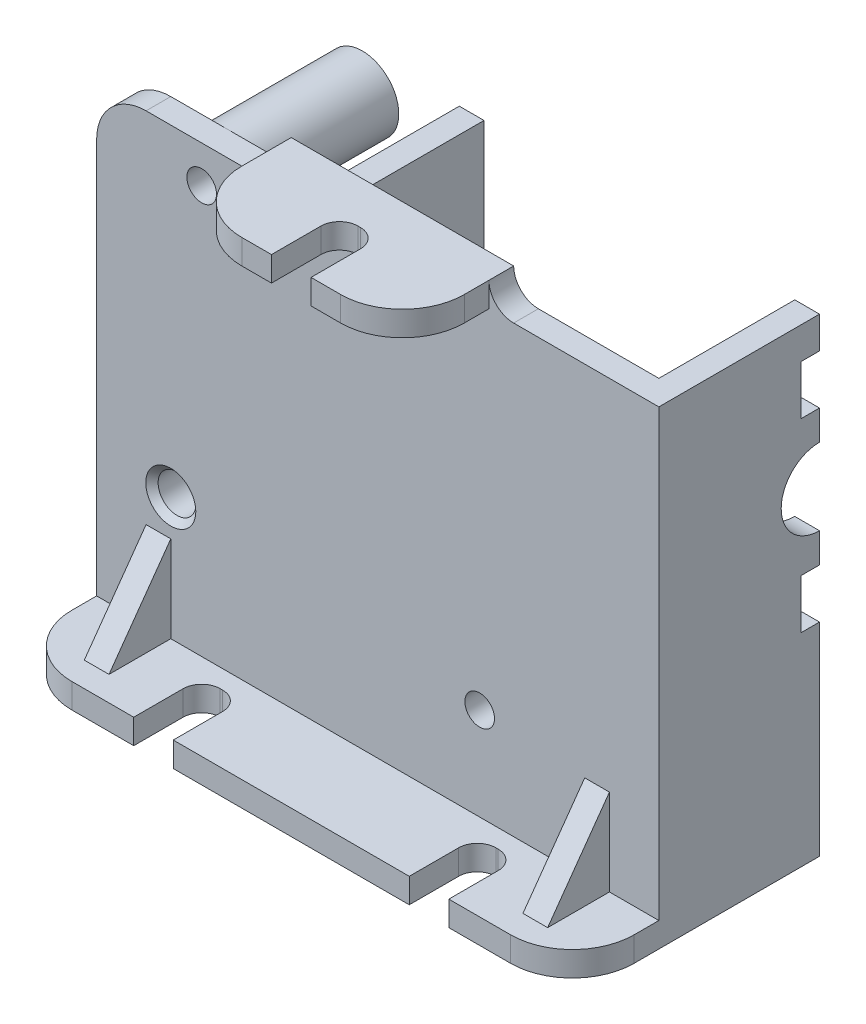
SolidWorks part; units mm, degrees
ref_plane "Face" through (0, 0, 0) normal (0, 0, 1) x (1, 0, 0)
ref_plane "Dessus" through (0, 0, 0) normal (0, 1, 0) x (1, 0, 0)
ref_plane "Droite" through (0, 0, 0) normal (1, 0, 0) x (0, 0, -1)
sketch "Esquisse1" plane through (0, 0, 0) normal (0, 0, 1) x (1, 0, 0)
  line L0 (-18.636, 0) -> (40.6725, 0) construction
  line L1 (0, 13.4516) -> (0, -31.9474) construction
  line L2 (-13.58, -13.58) -> (12.9107, -13.58) construction
  line L3 (11, 10.3689) -> (11, -7.2863) construction
  line L4 (12.35, 12.5556) -> (12.35, -11.4741) construction
  line L5 (37.5, 12.5556) -> (37.5, -10.7539) construction
  line L6 (-16.5535, -25.5) -> (42.4584, -25.5) construction
  line L7 (-16.0297, -27.5) -> (41.191, -27.5) construction
  line L8 (-6, 14.3889) -> (-6, -30.5277) construction
  line L9 (12.35, 10.45) -> (38.7737, 10.45) construction
  line L10 (11.7976, -10.45) -> (39.5594, -10.45) construction
  line L11 (39.5, 11.377) -> (39.5, -30.9205) construction
  line L12 (-10.1369, 12.5) -> (39.5, 12.5) construction
  line L14 (-6, 12.5) -> (39.5, 12.5)
  line L15 (-6, 12.5) -> (-6, -25.5)
  line L16 (-6, -25.5) -> (39.5, -25.5)
  line L17 (39.5, 12.5) -> (39.5, -25.5)
  circle A0 centre (0, -13.58) radius 11.5 construction
  circle A1 centre (0, -13.58) radius 1.5
extrude "Base-Extrusion" add sketch "Esquisse1" along normal mid plane 26
sketch "Esquisse5" plane through (0, 12.5, 0) normal (0, 1, 0) x (-1, 0, 0)
  line L0 (-12.35, -16.3279) -> (-12.35, 15.7701) construction
  line L1 (-10.35, -15.9222) -> (-10.35, 14.6545) construction
  line L2 (-37.5, -14.3503) -> (-37.5, 16.7842) construction
  line L3 (-39.5, -13.7925) -> (-39.5, 16.3786) construction
  line L4 (-40.8108, 11) -> (9.1448, 11) construction
  line L5 (-41.2165, -11) -> (8.3249, -11) construction
  line L7 (-37.5, 11) -> (-12.35, 11)
  line L8 (-37.5, 11) -> (-37.5, -11)
  line L9 (-37.5, -11) -> (-12.35, -11)
  line L10 (-12.35, 11) -> (-12.35, -11)
  line L11 (-10.35, 11) -> (8.7031, 11)
  line L12 (-10.35, 11) -> (-10.35, -11)
  line L13 (-10.35, -11) -> (8.7031, -11)
  line L14 (8.7031, 11) -> (8.7031, -11)
extrude "Enlèv. mat.-Extru.6" cut sketch "Esquisse5" against normal blind 40
sketch "Esquisse3" plane through (0, 0, 13) normal (0, 0, 1) x (1, 0, 0)
  circle A0 centre (0, -13.58) radius 3.5
extrude "Boss.-Extru.1" add sketch "Esquisse3" against normal blind 25
sketch "Esquisse4" plane through (0, 0, 13) normal (0, 0, 1) x (1, 0, 0)
  circle A0 centre (0, -13.58) radius 1.525
extrude "Enlèv. mat.-Extru.2" cut sketch "Esquisse4" against normal through all
sketch "Esquisse6" plane through (39.5, 0, 0) normal (1, 0, 0) x (0, 0, -1)
  line L0 (-13.8762, 0) -> (18.6073, 0) construction
  line L1 (0, 14.021) -> (0, -22.5589) construction
  circle A0 centre (0, 0.42) radius 3.025
extrude "Enlèv. mat.-Extru.3" cut sketch "Esquisse6" against normal through all
sketch "Esquisse7" plane through (39.5, 0, 0) normal (1, 0, 0) x (0, 0, -1)
  circle A0 centre (0, 0.42) radius 3.1
extrude "Enlèv. mat.-Extru.4" cut sketch "Esquisse7" against normal blind 3
sketch "Esquisse8" plane through (0, -25.5, 0) normal (0, -1, 0) x (1, 0, 0)
  line L0 (-6, 21.1962) -> (-6, -20.9902) construction
  line L1 (39.5, 20.4108) -> (39.5, -20.9902) construction
  line L2 (41.0671, -20) -> (-8.3785, -20) construction
  line L3 (-7.8207, 20) -> (40.3571, 20) construction
  line L5 (-6, 20) -> (39.5, 20)
  line L6 (-6, 20) -> (-6, 11.9399)
  line L7 (-6, 11.9399) -> (39.5, 11.9399)
  line L8 (39.5, 20) -> (39.5, 11.9399)
  line L9 (-6, -20) -> (39.5, -20)
  line L10 (-6, -20) -> (-6, -11.5095)
  line L11 (-6, -11.5095) -> (39.5, -11.5095)
  line L12 (39.5, -20) -> (39.5, -11.5095)
extrude "Boss.-Extru.2" add sketch "Esquisse8" against normal blind 2
sketch "Esquisse9" plane through (0, 12.5, 0) normal (0, 1, 0) x (-1, 0, 0)
  line L0 (6.6791, -3.1) -> (-6.4741, -3.1) construction
  line L1 (7.282, 3.1) -> (-7.5154, 3.1) construction
  line L3 (6.6791, -3.1) -> (-4.7203, -3.1)
  line L4 (6.6791, -3.1) -> (6.6791, 3.1)
  line L5 (6.6791, 3.1) -> (-4.7203, 3.1)
  line L6 (-4.7203, -3.1) -> (-4.7203, 3.1)
extrude "Enlèv. mat.-Extru.5" cut sketch "Esquisse9" against normal blind 32
sketch "Esquisse12" plane through (0, 0, 0) normal (0, 0, 1) x (1, 0, 0)
  line L0 (-4.6513, 9.5) -> (15.1881, 9.5) construction
  line L1 (18.2023, -16) -> (33.4929, -16) construction
  line L2 (25, -8.6922) -> (25, -25.0789) construction
  line L3 (2.5, 14.9287) -> (2.5, -0.5811) construction
  circle A0 centre (2.5, 9.5) radius 2.95
  circle A1 centre (25, -16) radius 2.95
extrude "Boss.-Extru.3" add sketch "Esquisse12" along normal mid plane 26
sketch "Esquisse13" plane through (0, 0, 0) normal (0, 0, 1) x (1, 0, 0)
  circle A0 centre (2.5, 9.5) radius 1.2
  circle A1 centre (25, -16) radius 1.2
extrude "Enlèv. mat.-Extru.8" cut sketch "Esquisse13" against normal mid plane 32
sketch "Esquisse14" plane through (0, -23.5, 0) normal (0, 1, 0) x (-1, 0, 0)
  line L0 (8.0853, 0) -> (-43.1429, 0) construction
  line L1 (-4, -22.6142) -> (-4, -6.692) construction
  line L2 (-39.5, -22.6142) -> (-39.5, -10.961) construction
  line L3 (-16.75, -22.0374) -> (-16.75, -8.8265) construction
  line L4 (-7.2, -22.0374) -> (-7.2, -8.8265) construction
  line L5 (2.9509, -14.5) -> (-11.9906, -14.5) construction
  line L6 (-26.3, -21.5758) -> (-26.3, -16)
  line L7 (-4, -21.5758) -> (-7.2, -21.5758)
  line L8 (-4, -21.5758) -> (-4, -16)
  line L9 (-5.5, -14.5) -> (-5.7, -14.5)
  line L10 (-7.2, -21.5758) -> (-7.2, -16)
  line L11 (-28, -14.5) -> (-27.8, -14.5)
  line L12 (-29.5, -21.5758) -> (-29.5, -16)
  line L13 (-29.5, -21.5758) -> (-26.3, -21.5758)
  line L14 (-29.5, 21.5758) -> (-26.3, 21.5758)
  line L15 (-29.5, 21.5758) -> (-29.5, 16)
  line L16 (-28, 14.5) -> (-27.8, 14.5)
  line L17 (-7.2, 21.5758) -> (-7.2, 16)
  line L18 (-5.5, 14.5) -> (-5.7, 14.5)
  line L19 (-4, 21.5758) -> (-4, 16)
  line L20 (-4, 21.5758) -> (-7.2, 21.5758)
  line L21 (-26.3, 21.5758) -> (-26.3, 16)
  arc A0 (-5.5, -14.5) -> (-4, -16) centre (-5.5, -16) cw
  arc A1 (-7.2, -16) -> (-5.7, -14.5) centre (-5.7, -16) cw
  arc A2 (-26.3, -16) -> (-27.8, -14.5) centre (-27.8, -16) ccw
  arc A3 (-28, -14.5) -> (-29.5, -16) centre (-28, -16) ccw
  arc A4 (-28, 14.5) -> (-29.5, 16) centre (-28, 16) cw
  arc A5 (-26.3, 16) -> (-27.8, 14.5) centre (-27.8, 16) cw
  arc A6 (-7.2, 16) -> (-5.7, 14.5) centre (-5.7, 16) ccw
  arc A7 (-5.5, 14.5) -> (-4, 16) centre (-5.5, 16) ccw
  dimension "D1" = 1.5
extrude "Enlèv. mat.-Extru.9" cut sketch "Esquisse14" against normal through all
sketch "Esquisse15" plane through (39.5, 0, 0) normal (1, 0, 0) x (0, 0, -1)
  line L0 (-1.5, 9.8002) -> (-1.5, -10.1958) construction
  line L1 (1.5, 9.3323) -> (1.5, -9.7969) construction
  line L2 (-3.0488, 7.5) -> (3.8686, 7.5) construction
  line L3 (-5.6888, 0.42) -> (7.1769, 0.42) construction
  line L4 (-2.4473, 9.92) -> (3.3339, 9.92) construction
  line L5 (-2.4473, 5.92) -> (3.5389, 5.92) construction
  line L6 (-1.5, -5.08) -> (-1.5, -9.08)
  line L7 (1.5, 5.92) -> (-1.5, 5.92)
  line L8 (1.5, 5.92) -> (1.5, 9.92)
  line L9 (1.5, 9.92) -> (-1.5, 9.92)
  line L10 (-1.5, 5.92) -> (-1.5, 9.92)
  line L11 (1.5, -9.08) -> (-1.5, -9.08)
  line L12 (1.5, -5.08) -> (1.5, -9.08)
  line L13 (1.5, -5.08) -> (-1.5, -5.08)
extrude "Enlèv. mat.-Extru.10" cut sketch "Esquisse15" against normal blind 3
fillet "Congé1" radius 5
fillet "Congé2" radius 4
chamfer "Chanfrein1" distance 0.5 angle 45
sketch "Esquisse16" plane through (0, 0, 0) normal (0, 0, 1) x (1, 0, 0)
  line L1 (-8.9898, 14.583) -> (40.4766, 14.583)
  line L2 (-8.9898, 14.583) -> (-8.9898, -26.083)
  line L3 (-8.9898, -26.083) -> (40.4766, -26.083)
  line L4 (40.4766, 14.583) -> (40.4766, -26.083)
extrude "Enlèv. mat.-Extru.11" cut sketch "Esquisse16" against normal blind 30
sketch "Esquisse17" plane through (0, 0, 0) normal (0, 0, -1) x (-1, 0, 0)
  line L0 (-24.3953, -13.58) -> (-5.104, -13.58) construction
  line L1 (-14.1468, -6.58) -> (-8.2826, -6.58) construction
  line L2 (-14.4756, -20.58) -> (-7.899, -20.58) construction
  line L4 (-13.7083, -6.58) -> (-8.8855, -6.58)
  line L5 (-13.7083, -6.58) -> (-13.7083, -20.58)
  line L6 (-13.7083, -20.58) -> (-8.8855, -20.58)
  line L7 (-8.8855, -6.58) -> (-8.8855, -20.58)
extrude "Enlèv. mat.-Extru.12" cut sketch "Esquisse17" against normal blind 3
sketch "Esquisse18" plane through (0, -23.5, 0) normal (0, 1, 0) x (-1, 0, 0)
  line L0 (-35.5, 7.0082) -> (-35.5, 24.6038) construction
  line L1 (-33.5, 8.1238) -> (-33.5, 24.0967) construction
  line L2 (2, 9.9493) -> (2, 22.2206) construction
  line L3 (0, 9.9493) -> (0, 22.5755) construction
  line L4 (3.2542, 13) -> (-38.4275, 13) construction
  line L5 (3.7105, 18) -> (-39.9488, 18) construction
  line L7 (-35.5, 18) -> (-33.5, 18)
  line L8 (-35.5, 18) -> (-35.5, 12.6368)
  line L9 (-35.5, 12.6368) -> (-33.5, 12.6368)
  line L10 (-33.5, 18) -> (-33.5, 12.6368)
  line L11 (0, 18) -> (2, 18)
  line L12 (0, 18) -> (0, 12.6368)
  line L13 (0, 12.6368) -> (2, 12.6368)
  line L14 (2, 18) -> (2, 12.6368)
extrude "Boss.-Extru.4" add sketch "Esquisse18" along normal blind 7
chamfer "Chanfrein2" distance 7 distance2 5
sketch "Esquisse20" plane through (0, 12.5, 0) normal (0, 1, 0) x (-1, 0, 0)
  line L0 (-16.75, 0.5177) -> (-16.75, 30.1787) construction
  line L1 (-31.1212, 20) -> (3.4615, 20) construction
  line L2 (-29.8743, 11) -> (9.2362, 11) construction
  line L3 (-18.35, 12.1983) -> (-18.35, 23.6165) construction
  line L4 (-25.75, 9.6391) -> (-25.75, 28.6038) construction
  line L5 (-28, 14.5) -> (-11.0409, 14.5) construction
  line L6 (-7.75, 11) -> (-25.75, 11)
  line L7 (-25.75, 11) -> (-25.75, 20)
  line L8 (-25.75, 20) -> (-18.35, 20)
  line L9 (-18.35, 20) -> (-18.35, 16)
  line L10 (-16.85, 14.5) -> (-16.65, 14.5)
  line L11 (-15.15, 20) -> (-15.15, 16)
  line L12 (-7.75, 20) -> (-15.15, 20)
  line L13 (-7.75, 11) -> (-7.75, 20)
  arc A0 (-16.85, 14.5) -> (-18.35, 16) centre (-16.85, 16) cw
  arc A1 (-16.65, 14.5) -> (-15.15, 16) centre (-16.65, 16) ccw
  point P23 (-16.75, 14.5)
  point P26 (-16.75, 11)
  dimension "D1" = 1.5
extrude "Boss.-Extru.5" add sketch "Esquisse20" along normal blind 2
fillet "Congé3" radius 2
fillet "Congé5" radius 5
